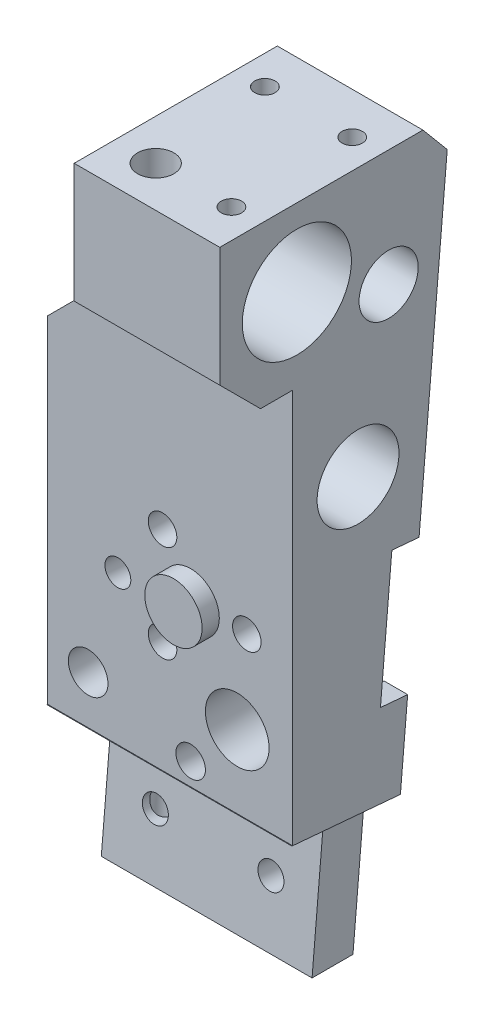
SolidWorks part; units mm, degrees
ref_plane "Front" through (0, 0, 0) normal (0, 0, 1) x (1, 0, 0)
ref_plane "Top" through (0, 0, 0) normal (0, 1, 0) x (1, 0, 0)
ref_plane "Right" through (0, 0, 0) normal (1, 0, 0) x (0, 0, -1)
sketch "Sketch1" plane through (0, 0, 0) normal (0, 0, 1) x (1, 0, 0)
  line L1 (-12.4968, 34.3911) -> (8.89, 34.3911)
  line L2 (-12.4968, 34.3911) -> (-12.4968, -27.8389)
  line L3 (-12.4968, -27.8389) -> (8.89, -27.8389)
  line L4 (8.89, 34.3911) -> (8.89, -27.8389)
  dimension "D1" = 8.89
  dimension "D2" = 12.4968
  dimension "D3" = 62.23
  dimension "D4" = 27.8389
  dimension "D5" = 34.3911
extrude "Extrude1" add sketch "Sketch1" along normal blind 13.716
sketch "Sketch2" plane through (0, 0, 0) normal (1, 0, 0) x (0, 0, -1)
  line L0 (0, 34.3911) -> (0, -27.8389)
  line L1 (0, -27.8389) -> (-5.4444, -27.8389)
  line L3 (-5.4444, -27.8389) -> (0, 34.3911)
  line L4 (-13.716, 34.3911) -> (0, 34.3911) construction
  line L5 (-13.716, -27.8389) -> (0, -27.8389) construction
  dimension "D1" = 5
extrude "Cut-Extrude2" cut sketch "Sketch2" against normal through all and the other way through all
sketch "Sketch4" plane through (0, 0, 0) normal (1, 0, 0) x (0, 0, -1)
  line L0 (-9.014, -27.8389) -> (-13.716, -27.8389)
  line L1 (0, 34.3911) -> (-5.4444, -27.8389) construction
  line L3 (-13.716, -27.8389) -> (-13.716, -13.3609)
  line L4 (-13.716, -13.3609) -> (-7.7927, -13.8791)
  line L5 (-7.7927, -13.8791) -> (-9.014, -27.8389)
  line L9 (-13.716, -27.8389) -> (-5.4444, -27.8389) construction
  line L10 (-13.716, -27.8389) -> (-13.716, 34.3911) construction
  line L11 (-13.716, 34.3911) -> (0, 34.3911) construction
  dimension "D1" = 47.752
  dimension "D2" = 3.556
extrude "Cut-Extrude3" cut sketch "Sketch4" against normal through all and the other way through all
sketch "Sketch8" plane through (-12.4968, 0, 0) normal (-1, 0, 0) x (0, 0, 1)
  line L0 (3.6734, -7.5962) -> (2.6772, 3.7903)
  line L1 (0, 34.3911) -> (5.4444, -27.8389) construction
  line L2 (2.6772, 3.7903) -> (5.0494, 3.9979)
  line L3 (5.0494, 3.9979) -> (6.0456, -7.3886)
  line L4 (6.0456, -7.3886) -> (3.6734, -7.5962)
  dimension "D1" = 2.3813
  dimension "D2" = 11.43
  dimension "D3" = 20.32
ref_plane "sensor" through (0, 0.3652, 4.1746) normal (0, -0.0872, -0.9962) x (-1, 0, 0)
sketch "Sketch9" plane through (8.89, 0, 0) normal (1, 0, 0) x (0, 0, -1)
  line L0 (-5.4444, -27.8389) -> (-9.014, -27.8389)
  line L1 (-9.014, -27.8389) -> (-7.7927, -13.8791)
  line L2 (-5.4444, -27.8389) -> (-4.2502, -14.189)
  line L3 (0, 34.3911) -> (-5.4444, -27.8389) construction
  line L4 (-9.014, -27.8389) -> (-7.7927, -13.8791) construction
  line L5 (-7.7927, -13.8791) -> (-4.2502, -14.189)
  line L6 (-7.7927, -13.8791) -> (-13.716, -13.3609) construction
extrude "Cut-Extrude4" cut sketch "Sketch9" against normal up to surface (3 mm away)
extrude "Cut-Extrude5" cut sketch "Sketch8" against normal through all
sketch "Sketch10" plane through (0, 0, 13.716) normal (0, 0, 1) x (1, 0, 0)
  line L0 (-12.4968, 34.3911) -> (-12.4968, -13.3609) construction
  line L1 (8.89, 34.3911) -> (-12.4968, 34.3911)
  line L2 (8.89, 34.3911) -> (8.89, 20.4211)
  line L3 (8.89, 20.4211) -> (-12.4968, 20.4211)
  line L4 (-12.4968, 34.3911) -> (-12.4968, 20.4211)
  dimension "D1" = 13.97
extrude "Extrude2" add sketch "Sketch10" along normal blind 6.35
sketch "Sketch13" plane through (8.89, 0, 0) normal (1, 0, 0) x (0, 0, -1)
  circle A0 centre (-13.3386, 27.6464) radius 1.4986
  circle A1 centre (-13.3386, 27.6464) radius 3 construction
  dimension "D1" = 2.9972
extrude "Cut-Extrude9" cut sketch "Sketch13" against normal through all
sketch "Sketch20" plane through (0, 34.3911, 0) normal (0, 1, 0) x (-1, 0, 0)
  line L0 (-8.89, 20.066) -> (-8.89, 0) construction
  line L1 (12.4968, 20.066) -> (3.81, 20.066)
  line L2 (12.4968, 20.066) -> (12.4968, 0)
  line L3 (12.4968, 0) -> (3.81, 0)
  line L4 (3.81, 20.066) -> (3.81, 0)
  line L5 (-8.89, 0) -> (12.4968, 0) construction
  dimension "D1" = 12.7
extrude "Cut-Extrude10" cut sketch "Sketch20" against normal up to surface (13.97 mm away)
sketch "Sketch21" plane through (-3.81, 0, 0) normal (-1, 0, 0) x (0, 0, 1)
  circle A0 centre (13.3386, 27.6464) radius 4.7587
  circle A1 centre (13.3386, 27.6464) radius 1.4986 construction
  dimension "D1" = 9.5174
extrude "Cut-Extrude11" cut sketch "Sketch21" against normal through all
hole_wizard "#5-40 Tapped Hole1" positions "Sketch23" profile "Sketch22" tap size "#5-40" standard "Ansi Inch"
sketch "Sketch23" plane through (0, 0.2612, 2.986) normal (0, -0.0872, -0.9962) x (-1, 0, 0)
  circle A0 centre (0, -13.2074) radius 1.75 construction
  circle A1 centre (0, 16.7926) radius 1.75 construction
  point P0 (0, 16.7926)
  point P1 (0, -13.2074)
sketch "Sketch22" plane through (0, 16.9899, 1.5224) normal (1, 0, 0) x (0, 0.9962, -0.0872)
  line L0 (0, 0) -> (0, 10.8075)
  line L1 (0, 10.8075) -> (1.289, 10.033)
  line L2 (1.289, 10.033) -> (1.289, 0)
  line L5 (1.289, 0) -> (0, 0)
  line L10 (0, 10.8075) -> (-1.2891, 10.033) construction
  line L11 (0, -6.35) -> (0, 107.95) construction
  dimension "Tap Drill Dia." = 2.5781
  dimension "Tap Drill Depth" = 10.033
  dimension "Drill Angle" = 118
hole_wizard "#4-40 Tapped Hole1" positions "Sketch25" profile "Sketch24" tap size "#4-40" standard "Ansi Inch"
sketch "Sketch25" plane through (0, 0.5712, 6.5284) normal (0, 0.0872, 0.9962) x (1, 0, 0)
  line L2 (-12.4968, -28.5185) -> (-12.4968, -14.5054) construction
  line L3 (-12.4968, -28.5185) -> (5.89, -28.5185) construction
  point P0 (-8.258, -23.0331)
  point P1 (1.826, -23.0331)
  dimension "D1" = 4.2388
  dimension "D2" = 14.3228
  dimension "D3" = 5.4854
  dimension "D4" = 5.4854
sketch "Sketch24" plane through (-8.258, -22.3743, 8.5359) normal (1, 0, 0) x (0, -0.9962, 0.0872)
  line L0 (0, 0) -> (0, 8.9797)
  line L1 (0, 8.9797) -> (1.1303, 8.9797)
  line L2 (1.1303, 8.9797) -> (1.1303, 0)
  line L5 (1.1303, 0) -> (0, 0)
  line L11 (0, -6.35) -> (0, 107.95) construction
  dimension "Thru Tap Drill Dia." = 2.2606
  dimension "Thru Tap Drill Depth" = 8.9797
sketch "Sketch26" plane through (0, 0, 13.716) normal (0, 0, 1) x (1, 0, 0)
  circle A0 centre (0, 0) radius 2.5006
  circle A1 centre (0, 0) radius 2.5 construction
  dimension "D1" = 5.0013
extrude "Extrude4" add sketch "Sketch26" along normal blind 1.5
hole_wizard "CBORE for #3 Fillister Head Machine Screw2" positions "Sketch32" profile "Sketch31" counterbore size "#3" standard "Ansi Inch"
sketch "Sketch32" plane through (0, 0, 0) normal (0, 0, 1) x (1, 0, 0)
  circle A0 centre (-2.45, 4.2435) radius 0.8 construction
  circle A1 centre (-2.45, -4.2435) radius 0.8 construction
  circle A2 centre (4.9, 0) radius 0.8 construction
  point P0 (-2.45, -4.2435)
  point P1 (-2.45, 4.2435)
  point P2 (4.9, 0)
sketch "Sketch31" plane through (-2.45, -4.2435, 0) normal (1, 0, 0) x (0, 1, 0)
  line L0 (0, 0) -> (0, 20.066)
  line L1 (0, 20.066) -> (1.2446, 20.066)
  line L3 (1.2446, 20.066) -> (1.2446, 10.668)
  line L4 (1.2446, 10.668) -> (2.2352, 10.668)
  line L5 (2.2352, 10.668) -> (2.2352, 0)
  line L7 (2.2352, 0) -> (0, 0)
  line L11 (0, -6.35) -> (0, 107.95) construction
  dimension "Thru Hole Dia." = 2.4892
  dimension "Thru Hole Depth" = 20.066
  dimension "C'Bore Dia." = 4.4704
  dimension "C'Bore Depth" = 10.668
hole_wizard "#4-40 Tapped Hole2" positions "Sketch34" profile "Sketch33" tap size "#4-40" standard "Ansi Inch"
sketch "Sketch34" plane through (0, 0.4688, 5.3582) normal (0, -0.0872, -0.9962) x (-1, 0, 0)
  circle A0 centre (6.35, -2.1724) radius 1.6319 construction
  point P0 (6.35, -2.1724)
sketch "Sketch33" plane through (-6.35, -1.6954, 5.5475) normal (1, 0, 0) x (0, 0.9962, -0.0872)
  line L0 (0, 0) -> (0, 17.6084)
  line L1 (0, 17.6084) -> (1.1303, 17.6084)
  line L2 (1.1303, 17.6084) -> (1.1303, 0)
  line L5 (1.1303, 0) -> (0, 0)
  line L11 (0, -6.35) -> (0, 107.95) construction
  dimension "Thru Tap Drill Dia." = 2.2606
  dimension "Thru Tap Drill Depth" = 17.6084
hole_wizard "1/8 (0.125) Diameter Hole1" positions "Sketch37" profile "Sketch36" hole size "1/8" standard "Ansi Inch"
sketch "Sketch37" plane through (0, 34.3911, 0) normal (0, 1, 0) x (-1, 0, 0)
  line L0 (3.81, 20.066) -> (3.81, 0) construction
  line L2 (-8.89, 20.066) -> (3.81, 20.066) construction
  point P0 (0.254, 16.51)
  dimension "D1" = 3.556
  dimension "D2" = 3.556
sketch "Sketch36" plane through (-0.254, 34.3911, 16.51) normal (1, 0, 0) x (0, 0, 1)
  line L0 (0, 0) -> (0, 4.572)
  line L1 (0, 4.572) -> (1.5837, 4.572)
  line L2 (1.5837, 4.572) -> (1.5837, 0)
  line L5 (1.5837, 0) -> (0, 0)
  line L10 (0, 4.572) -> (-1.5837, 4.572) construction
  line L11 (0, -6.35) -> (0, 107.95) construction
  dimension "Hole Dia." = 3.1674
  dimension "Hole Depth" = 4.572
  dimension "Drill Angle" = 180
hole_wizard "#2-56 Tapped Hole1" positions "Sketch39" profile "Sketch38" tap size "#2-56" standard "Ansi Inch"
sketch "Sketch39" plane through (0, 34.3911, 0) normal (0, 1, 0) x (-1, 0, 0)
  circle A0 centre (-6.35, 5.969) radius 1.1303 construction
  circle A1 centre (-6.35, 16.51) radius 1.1303 construction
  circle A2 centre (1.27, 5.969) radius 1.1303 construction
  point P0 (1.27, 5.969)
  point P1 (-6.35, 5.969)
  point P2 (-6.35, 16.51)
sketch "Sketch38" plane through (-1.27, 34.3911, 5.969) normal (1, 0, 0) x (0, 0, 1)
  line L0 (0, 0) -> (0, 4.4458)
  line L1 (0, 4.4458) -> (0.889, 3.9116)
  line L2 (0.889, 3.9116) -> (0.889, 0)
  line L5 (0.889, 0) -> (0, 0)
  line L10 (0, 4.4458) -> (-0.889, 3.9116) construction
  line L11 (0, -6.35) -> (0, 107.95) construction
  dimension "Tap Drill Dia." = 1.778
  dimension "Tap Drill Depth" = 3.9116
  dimension "Drill Angle" = 118
hole_wizard "#8-32 Tapped Hole1" positions "Sketch42" profile "Sketch41" tap size "#8-32" standard "Ansi Inch"
sketch "Sketch42" plane through (0, 0, 13.716) normal (0, 0, 1) x (1, 0, 0)
  line L0 (-12.4968, -13.3609) -> (8.89, -13.3609) construction
  line L1 (-12.4968, 20.4211) -> (-12.4968, -13.3609) construction
  point P0 (-8.9408, -9.8049)
  dimension "D1" = 3.556
  dimension "D2" = 3.556
sketch "Sketch41" plane through (-8.9408, -9.8049, 13.716) normal (1, 0, 0) x (0, -1, 0)
  line L0 (0, 0) -> (0, 13.716)
  line L1 (0, 13.716) -> (1.7272, 13.716)
  line L2 (1.7272, 13.716) -> (1.7272, 0)
  line L5 (1.7272, 0) -> (0, 0)
  line L11 (0, -6.35) -> (0, 107.95) construction
  dimension "Thru Tap Drill Dia." = 3.4544
  dimension "Thru Tap Drill Depth" = 13.716
sketch "Sketch43" plane through (0, -14.4502, 1.2642) normal (0, -0.9962, 0.0872) x (1, 0, 0)
  line L0 (-12.4968, 6.5534) -> (-12.4968, 12.4993) construction
  line L1 (8.89, 12.4993) -> (-12.4968, 12.4993)
  line L2 (8.89, 12.4993) -> (8.89, 2.9974)
  line L3 (8.89, 2.9974) -> (5.89, 2.9974)
  line L4 (-12.4968, 12.4993) -> (-12.4968, 6.5534)
  line L5 (5.89, 2.9974) -> (8.89, 2.9974) construction
  line L6 (-12.4968, 6.5534) -> (5.89, 6.5534)
  line L7 (5.89, 6.5534) -> (5.89, 2.9974)
extrude "Extrude5" add sketch "Sketch43" along normal blind 0.635
sketch "Sketch44" plane through (0, 0, 13.716) normal (0, 0, 1) x (1, 0, 0)
  line L1 (8.89, -13.3609) -> (-12.4968, -13.3609)
  line L2 (8.89, -13.3609) -> (8.89, -13.9934)
  line L3 (8.89, -13.9934) -> (-12.4968, -13.9934)
  line L4 (-12.4968, -13.3609) -> (-12.4968, -13.9934)
extrude "Cut-Extrude12" cut sketch "Sketch44" along normal through all
hole_wizard "9/32 (0.28125) Diameter Hole1" positions "Sketch49" profile "Sketch48" hole size "9/32" standard "Ansi Inch"
sketch "Sketch49" plane through (8.89, 0, 0) normal (1, 0, 0) x (0, 0, -1)
  line L0 (-13.716, -13.9934) -> (-13.716, 20.4211) construction
  line L5 (-20.066, 34.3911) -> (0, 34.3911) construction
  point P0 (-8.001, 11.0231)
  dimension "D1" = 5.715
  dimension "D2" = 23.368
sketch "Sketch48" plane through (8.89, 11.0231, 8.001) normal (0, 1, 0) x (0, 0, -1)
  line L0 (0, 0) -> (0, 21.3869)
  line L1 (0, 21.3869) -> (3.5719, 21.3869)
  line L2 (3.5719, 21.3869) -> (3.5719, 0)
  line L5 (3.5719, 0) -> (0, 0)
  line L11 (0, -6.35) -> (0, 107.95) construction
  dimension "Thru Hole Dia." = 7.1437
  dimension "Thru Hole Depth" = 21.3869
hole_wizard "13/64 (0.20313) Diameter Hole1" positions "Sketch53" profile "Sketch52" hole size "13/64" standard "Ansi Inch"
sketch "Sketch53" plane through (-3.81, 0, 0) normal (-1, 0, 0) x (0, 0, 1)
  line L0 (20.066, 34.3911) -> (0, 34.3911) construction
  line L1 (20.066, 20.4211) -> (20.066, 34.3911) construction
  point P0 (5.334, 24.2311)
  dimension "D1" = 10.16
  dimension "D2" = 14.732
sketch "Sketch52" plane through (-3.81, 24.2311, 5.334) normal (0, 1, 0) x (0, 0, 1)
  line L0 (0, 0) -> (0, 12.7001)
  line L1 (0, 12.7001) -> (2.5798, 12.7001)
  line L2 (2.5798, 12.7001) -> (2.5798, 0)
  line L5 (2.5798, 0) -> (0, 0)
  line L11 (0, -6.35) -> (0, 107.95) construction
  dimension "Thru Hole Dia." = 5.1595
  dimension "Thru Hole Depth" = 12.7001
chamfer "Chamfer1" distance 5.08 angle 45 1 edges
chamfer "Chamfer2" distance 2.54 angle 45 1 edges at (2.54, 34.3911, 0)
chamfer "Chamfer3" distance 3.556 angle 45 1 edges at (2.54, 20.4211, 20.066)
hole_wizard "M5.0 (5) Diameter Hole1" positions "Sketch55" profile "Sketch54" hole size "M5.0" standard "Ansi Metric"
sketch "Sketch55" plane through (0, 0, 13.716) normal (0, 0, 1) x (1, 0, 0)
  circle A0 centre (0, 0) radius 6.5 construction
  point P0 (0, 0)
sketch "Sketch54" plane through (0, 0, 13.716) normal (1, 0, 0) x (0, -1, 0)
  line L0 (0, 0) -> (0, 6.5532)
  line L1 (0, 6.5532) -> (2.5, 6.5532)
  line L2 (2.5, 6.5532) -> (2.5, 0)
  line L5 (2.5, 0) -> (0, 0)
  line L10 (0, 6.5532) -> (-2.5, 6.5532) construction
  line L11 (0, -6.35) -> (0, 107.95) construction
  dimension "Hole Dia." = 5
  dimension "Hole Depth" = 6.5532
  dimension "Drill Angle" = 180
sketch "Sketch56" plane through (-12.4968, 0, 0) normal (-1, 0, 0) x (0, 0, 1)
  line L0 (5.0494, 3.9979) -> (2.6772, 3.7903) construction
  line L1 (2.6772, 3.7903) -> (5.0519, 3.9981)
  line L2 (2.6772, 3.7903) -> (3.6734, -7.5962)
  line L3 (3.6734, -7.5962) -> (6.0481, -7.3884)
  line L4 (5.0519, 3.9981) -> (6.0481, -7.3884)
  line L5 (1.6667, 15.3411) -> (2.6772, 3.7903) construction
  dimension "D1" = 2.3838
  dimension "D2" = 11.43
extrude "Cut-Extrude13" cut sketch "Sketch56" against normal through all
sketch "Sketch58" plane through (0, 0, 13.716) normal (0, 0, 1) x (1, 0, 0)
  line L0 (8.89, -13.9934) -> (8.89, 20.4211) construction
  line L1 (8.89, -13.9934) -> (-12.4968, -13.9934) construction
  circle A0 centre (4.064, -7.6434) radius 2.7788
  dimension "D1" = 5.5575
  dimension "D2" = 4.826
  dimension "D3" = 6.35
extrude "Cut-Extrude14" cut sketch "Sketch58" against normal through all
ref_plane "Plane1" through (0, -28.41, 2.4856) normal (0, 0.9962, -0.0872) x (-1, 0, 0)
sketch "Sketch61" plane through (0, -28.41, 2.4856) normal (0, 0.9962, -0.0872) x (-1, 0, 0)
  line L0 (12.4968, 2.9974) -> (-5.89, 2.9974) construction
  line L1 (12.4968, 6.5534) -> (12.4968, 2.9974) construction
  circle A0 centre (9.3218, 4.7754) radius 1.143
  dimension "D3" = 2.286
  dimension "D1" = 1.778
  dimension "D2" = 3.175
extrude "Cut-Extrude15" cut sketch "Sketch61" along normal blind 0.381
hole_wizard "#4-40 Tapped Hole5" positions "3DSketch3" profile "Sketch62" tap size "#4-40" standard "Ansi Inch"
sketch3d "3DSketch3"
  line L0 (-12.4968, -27.8389, 9.014) -> (-12.4968, -27.8389, 5.4444) construction
  line L1 (-12.4968, -27.8389, 5.4444) -> (5.89, -27.8389, 5.4444) construction
  spline S0 degree 3 poles (-9.3218, -27.8389, 8.3766) (-11.6078, -27.8389, 8.3766) (-11.6078, -27.8389, 6.0818) (-9.3218, -27.8389, 6.0818) (-7.0358, -27.8389, 6.0818) (-7.0358, -27.8389, 8.3766) (-9.3218, -27.8389, 8.3766) (-11.6078, -27.8389, 8.3766) (-11.6078, -27.8389, 6.0818) knots -0.5 0 0 0 0.5 0.5 0.5 1 1 1 1.5 1.5 1.5 weights 1 0.333333 0.333333 1 0.333333 0.333333 1 0.333333 0.333333 only from (-9.3218, -27.8389, 8.3766) to (-9.3218, -27.8389, 8.3766) construction
  point P0 (-8.1788, -27.8389, 7.2292)
  point P4 (-9.3297, -27.6144, 7.2082)
  dimension "D1" = 3.175
  dimension "D2" = 1.778
sketch "Sketch62" plane through (-9.3297, -27.6144, 7.2082) normal (1, 0, 0) x (0, -0.0872, -0.9962)
  line L0 (0, 0) -> (0, 14.6238)
  line L1 (0, 14.6238) -> (1.1303, 13.9446)
  line L2 (1.1303, 13.9446) -> (1.1303, 0)
  line L5 (1.1303, 0) -> (0, 0)
  line L10 (0, 14.6238) -> (-1.1303, 13.9446) construction
  line L11 (0, -6.35) -> (0, 107.95) construction
  dimension "Tap Drill Dia." = 2.2606
  dimension "Tap Drill Depth" = 13.9446
  dimension "Drill Angle" = 118
